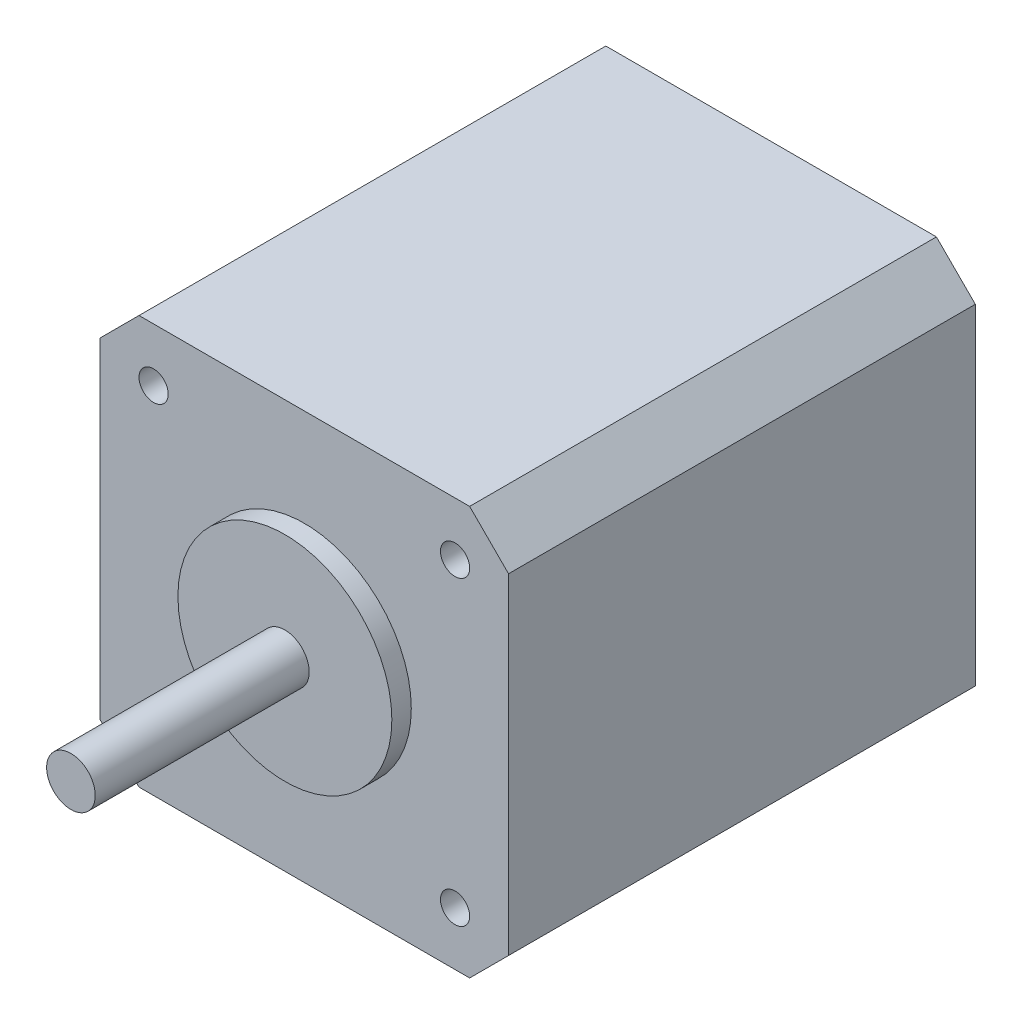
SolidWorks part; units mm, degrees
ref_plane "Спереди" through (0, 0, 0) normal (0, 0, 1) x (1, 0, 0)
ref_plane "Сверху" through (0, 0, 0) normal (0, 1, 0) x (1, 0, 0)
ref_plane "Справа" through (0, 0, 0) normal (1, 0, 0) x (0, 0, -1)
sketch "Эскиз1" plane through (0, 0, 0) normal (0, 0, 1) x (1, 0, 0)
  line L0 (0, 38) -> (4, 42)
  line L1 (4, 0) -> (38, 0)
  line L2 (0, 4) -> (0, 38)
  line L3 (4, 42) -> (38, 42)
  line L4 (42, 4) -> (42, 38)
  line L5 (38, 42) -> (42, 38)
  line L6 (38, 0) -> (42, 4)
  line L7 (0, 4) -> (4, 0)
  point P0 (0, 0)
  point P1 (42, 42)
  point P2 (0, 42)
  point P3 (42, 0)
  dimension "D1" = 42
  dimension "D2" = 42
extrude "Бобышка-Вытянуть1" add sketch "Эскиз1" along normal blind 48
sketch "Эскиз2" plane through (0, 0, 48) normal (0, 0, 1) x (1, 0, 0)
  line L0 (38, 42) -> (4, 42) construction
  line L1 (0, 38) -> (0, 4) construction
  circle A0 centre (21, 21) radius 11
  point P2 (21, 42)
  point P3 (0, 21)
  dimension "D1" = 22
extrude "Бобышка-Вытянуть2" add sketch "Эскиз2" along normal blind 2
sketch "Эскиз3" plane through (0, 0, 50) normal (0, 0, 1) x (1, 0, 0)
  line L0 (38, 42) -> (4, 42) construction
  line L1 (0, 38) -> (0, 4) construction
  circle A0 centre (21, 21) radius 2.5
  point P2 (21, 42)
  point P3 (0, 21)
  dimension "D1" = 5
extrude "Бобышка-Вытянуть3" add sketch "Эскиз3" along normal blind 22
sketch "Эскиз4" plane through (0, 0, 48) normal (0, 0, 1) x (1, 0, 0)
  line L0 (38, 42) -> (4, 42) construction
  line L1 (0, 38) -> (0, 4) construction
  line L3 (5.5, 36.5) -> (36.5, 36.5) construction
  line L4 (5.5, 36.5) -> (5.5, 5.5) construction
  line L5 (5.5, 5.5) -> (36.5, 5.5) construction
  line L6 (36.5, 36.5) -> (36.5, 5.5) construction
  circle A0 centre (5.5, 36.5) radius 1.5
  circle A1 centre (36.5, 36.5) radius 1.5
  circle A2 centre (5.5, 5.5) radius 1.5
  circle A3 centre (36.5, 5.5) radius 1.5
  point P8 (21, 42)
  point P9 (0, 21)
  point P12 (21, 36.5)
  point P15 (5.5, 21)
  dimension "D2" = 3
  dimension "D1" = 31
extrude "Вырез-Вытянуть1" cut sketch "Эскиз4" against normal blind 4.5
